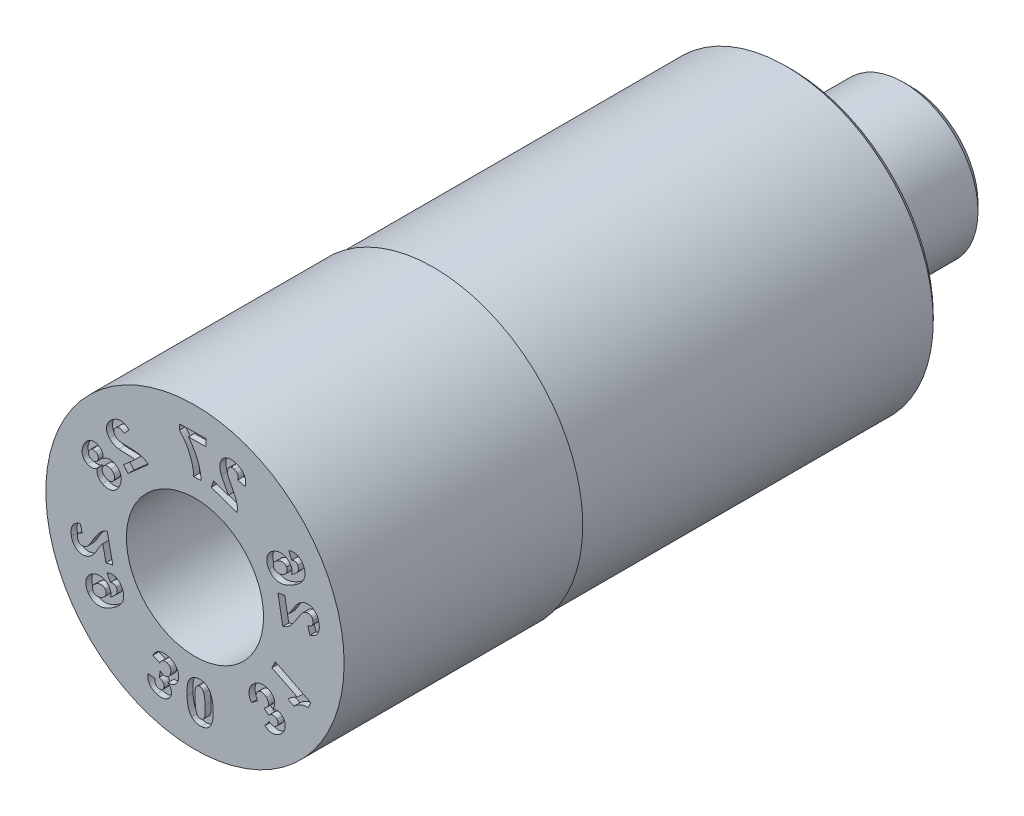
SolidWorks part; units mm, degrees
other "<M5 X .8 SHSS>-<Revolve1>"
ref_plane "Front Plane" through (0, 0, 0) normal (0, 0, 1) x (1, 0, 0)
ref_plane "Top Plane" through (0, 0, 0) normal (0, 1, 0) x (1, 0, 0)
ref_plane "Right Plane" through (0, 0, 0) normal (1, 0, 0) x (0, 0, -1)
sketch "Sketch1" plane through (0, 0, 0) normal (1, 0, 0) x (0, 0, -1)
  line L2 (0, 5) -> (0, 2.3)
  line L3 (19.75, 5) -> (0, 5)
  line L4 (-3.7979, 0) -> (49996.2021, 0) construction
  line L8 (16, 1.25) -> (4, 1.25)
  line L9 (4, 2.3) -> (4, 1.25)
  line L10 (4, 2.3) -> (0, 2.3)
  line L12 (20, 2.5) -> (20, 4.75)
  line L16 (20, 4.75) -> (19.75, 5)
  line L17 (20, 2.5) -> (16, 2.5)
  line L18 (16, 1.25) -> (16, 2.5)
  dimension "D1" = 20
  dimension "D2" = 45
  dimension "D3" = 0.25
  dimension "D4" = 10
  dimension "D5" = 4.6
  dimension "D6" = 4
  dimension "D7" = 2.5
  dimension "D8" = 5
  dimension "D9" = 4
revolve "Revolve1" add sketch "Sketch1" angle 360 about L4
sketch "Sketch4" plane through (0, 0, 0) normal (1, 0, 0) x (0, 0, -1)
  line L0 (0, 0) -> (50000, 0) construction
  line L1 (20, -4.75) -> (20, 4.75) construction
  line L2 (8, 5.935) -> (20, 5.935)
  line L3 (8, 5.935) -> (8, 4.935)
  line L4 (8, 4.935) -> (20, 4.935)
  line L5 (20, 5.935) -> (20, 4.935)
  line L6 (19.75, 5) -> (0, 5) construction
  line L9 (0, 5.5) -> (0, -5.5) construction
  dimension "D1" = 1
  dimension "D2" = 0.065
  dimension "D3" = 8
revolve "Cut-Revolve1" cut sketch "Sketch4" angle 360 about L0
sketch "Sketch2" plane through (0, 0, 0) normal (0, 0, 1) x (1, 0, 0)
  line L0 (0, 0) -> (0, 6.5633) construction
  line L1 (0, 0) -> (5.684, 3.2816) construction
  line L2 (0, 0) -> (5.684, -3.2816) construction
  line L3 (0, 0) -> (0, -6.5633) construction
  line L4 (0, 0) -> (-5.684, -3.2816) construction
  line L5 (0, 0) -> (-5.684, 3.2816) construction
  circle A0 centre (0, 0) radius 2.9521 construction
  text T0 "26  27  28  29  30  31" font "Arial" height 1.33
  point P11 (0, 0)
  point P1515 (0, 0.0075)
  point P1516 (0.0075, 0.0075)
  point P1517 (0.0075, 0)
  dimension "D1" = 6
extrude "Cut-Extrude1" cut sketch "Sketch2" against normal blind 0.2
sketch "Sketch3" plane through (0, 0, -4) normal (0, 0, 1) x (1, 0, 0)
  line L0 (0, 0) -> (0, 50000) construction
  line L1 (0.7217, 1.25) -> (-0.7217, 1.25)
  line L2 (-0.7217, 1.25) -> (-1.4434, 0)
  line L3 (-1.4434, 0) -> (-0.7217, -1.25)
  line L4 (-0.7217, -1.25) -> (0.7217, -1.25)
  line L5 (0.7217, -1.25) -> (1.4434, 0)
  line L6 (1.4434, 0) -> (0.7217, 1.25)
  line L7 (0, 0) -> (50000, 0) construction
  circle A0 centre (0, 0) radius 1.25 construction
  circle A1 centre (0, 0) radius 1.25 construction
extrude "Cut-Extrude2" cut sketch "Sketch3" against normal blind 2
inserted part "M5 X .8 SHSS"
move or copy body "Body-Move/Copy2" placed by mates yes
